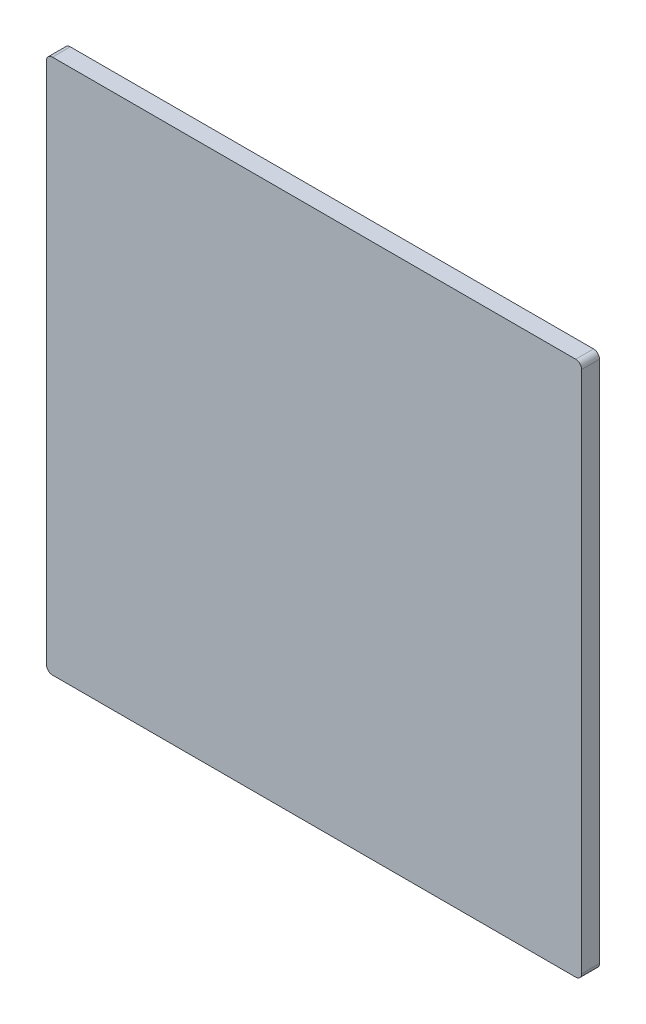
SolidWorks part; units mm, degrees
ref_plane "Front Plane" through (0, 0, 0) normal (0, 0, 1) x (1, 0, 0)
ref_plane "Top Plane" through (0, 0, 0) normal (0, 1, 0) x (1, 0, 0)
ref_plane "Right Plane" through (0, 0, 0) normal (1, 0, 0) x (0, 0, -1)
sketch "Sketch1" plane through (0, 0, 0) normal (0, 0, 1) x (1, 0, 0)
  line L1 (-114.3, -114.3) -> (114.3, -114.3)
  line L2 (-114.3, -114.3) -> (-114.3, 114.3)
  line L3 (-114.3, 114.3) -> (114.3, 114.3)
  line L4 (114.3, -114.3) -> (114.3, 114.3)
  line L5 (-114.3, -114.3) -> (114.3, 114.3) construction
  line L6 (-114.3, 114.3) -> (114.3, -114.3) construction
  point P0 (0, 0)
  dimension "D1" = 228.6
  dimension "D2" = 228.6
extrude "Boss-Extrude1" add sketch "Sketch1" along normal blind 7.62
fillet "Fillet1" radius 2.54 4 edges at (-114.3, -114.3, 3.81) (114.3, -114.3, 3.81) (-114.3, 114.3, 3.81) (114.3, 114.3, 3.81)
